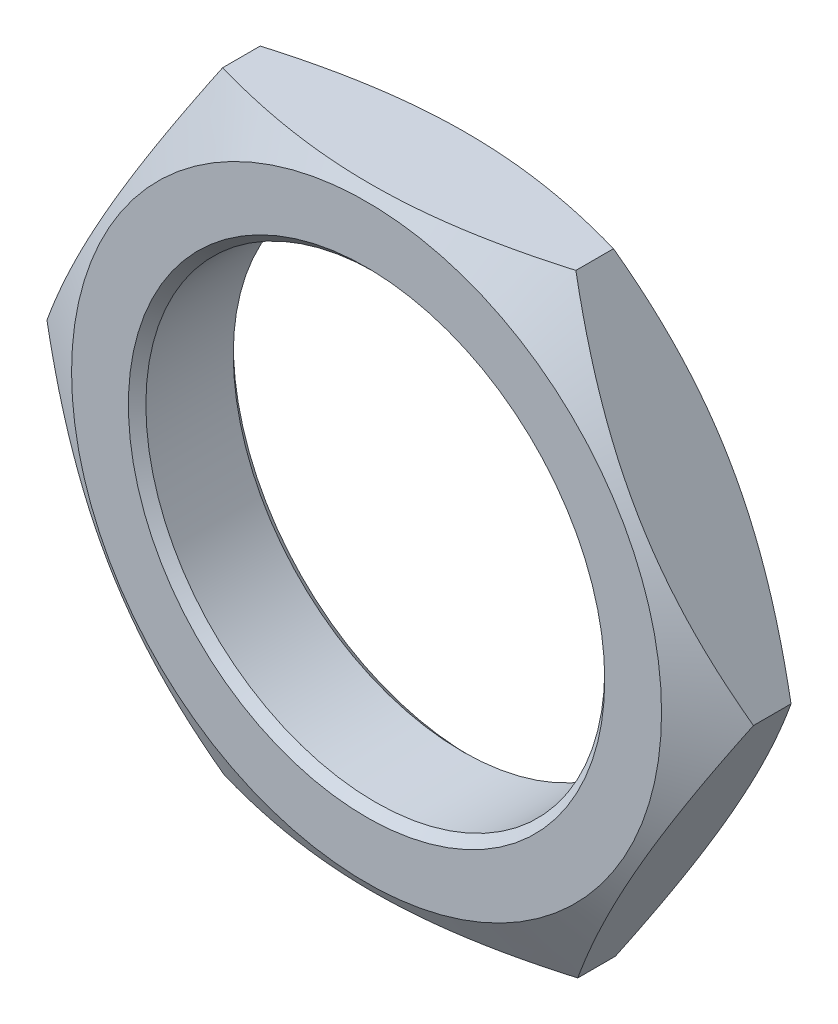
SolidWorks part; units mm, degrees
ref_plane "Plan de face" through (0, 0, 0) normal (0, 0, 1) x (1, 0, 0)
ref_plane "Plan de dessus" through (0, 0, 0) normal (0, 1, 0) x (1, 0, 0)
ref_plane "Plan de droite" through (0, 0, 0) normal (1, 0, 0) x (0, 0, -1)
sketch "Esquisse1" plane through (0, 0, 0) normal (0, 0, 1) x (1, 0, 0)
  line L1 (4.0632, -6.9874) -> (8.0829, 0.0251)
  line L2 (8.0829, 0.0251) -> (4.0197, 7.0125)
  line L3 (4.0197, 7.0125) -> (-4.0632, 6.9874)
  line L4 (-4.0632, 6.9874) -> (-8.0829, -0.0251)
  line L5 (-8.0829, -0.0251) -> (-4.0197, -7.0125)
  line L6 (-4.0197, -7.0125) -> (4.0632, -6.9874)
  circle A0 centre (0, 0) radius 7 construction
  circle A1 centre (0, 0) radius 5.25
  dimension "D2" = 8.0829
  dimension "D3" = 10.5
  dimension "D1" = 14
extrude "Boss.-Extru.1" add sketch "Esquisse1" along normal blind 2.4
sketch "Esquisse2" plane through (0, 0, 2.4) normal (0, 0, 1) x (1, 0, 0)
  circle A0 centre (0, 0) radius 6.75
  dimension "D1" = 13.5
extrude "Enlèv. mat.-Extru.3" cut sketch "Esquisse2" against normal blind 1 draft 60 flip side to cut
sketch "Esquisse3" plane through (0, 0, 0) normal (0, 0, -1) x (-1, 0, 0)
  circle A0 centre (0, 0) radius 6.75
  dimension "D1" = 13.5
extrude "Enlèv. mat.-Extru.4" cut sketch "Esquisse3" against normal blind 1 draft 60 flip side to cut
chamfer "Chanfrein2" distance 0.2 angle 45 2 edges at (5.25, 0, 2.4) (5.25, 0, 0)
